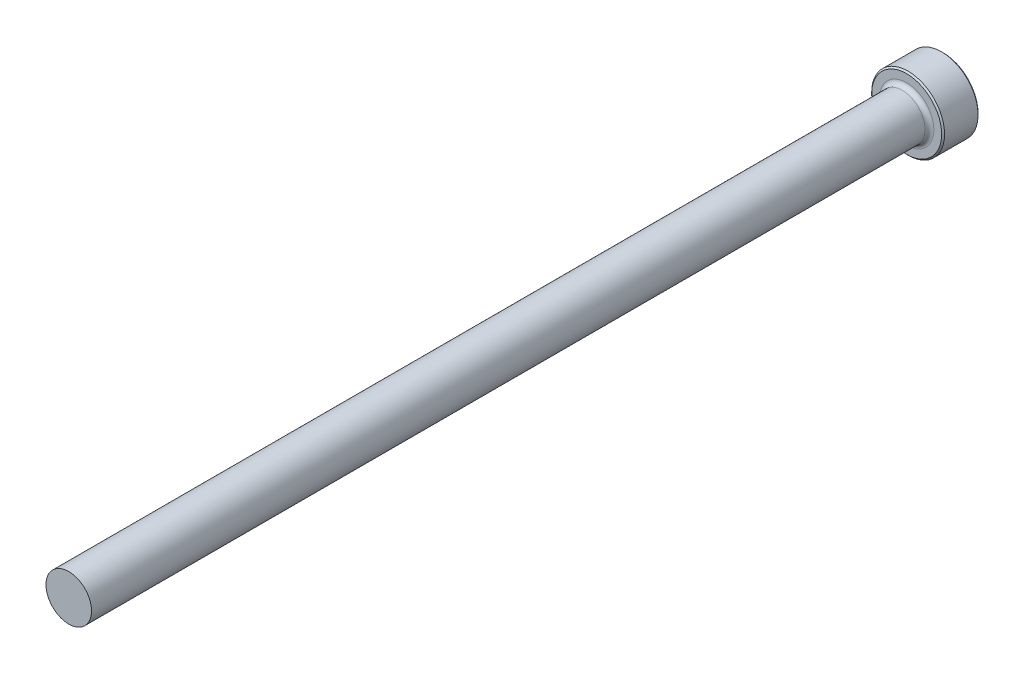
SolidWorks part; units mm, degrees
ref_plane "Front Plane" through (0, 0, 0) normal (0, 0, 1) x (1, 0, 0)
ref_plane "Top Plane" through (0, 0, 0) normal (0, 1, 0) x (1, 0, 0)
ref_plane "Right Plane" through (0, 0, 0) normal (1, 0, 0) x (0, 0, -1)
sketch "Sketch1" plane through (0, 0, 0) normal (1, 0, 0) x (0, 0, -1)
  line L0 (0, 0) -> (0, 6.35)
  line L1 (0, 6.35) -> (-6.35, 6.35)
  line L2 (-6.35, 6.35) -> (-6.35, 4.7307)
  line L3 (-7.112, 3.9687) -> (-152.4, 3.9687)
  line L4 (-152.4, 3.9687) -> (-152.4, 0)
  line L5 (-152.4, 0) -> (0, 0)
  line L6 (25.4347, 0) -> (-130.6739, 0) construction
  arc A0 (-6.35, 4.7307) -> (-7.112, 3.9687) centre (-7.112, 4.7307) cw
  dimension "D4" = 0.762
  dimension "D1" = 7.9375
  dimension "D2" = 12.7
  dimension "D3" = 6.35
  dimension "D5" = 152.4
revolve "Revolve1" add sketch "Sketch1" angle 360 about L6
chamfer "Chamfer1" distance 0.254 angle 45 2 edges at (-6.35, 0, 0) (-6.35, 0, 6.35)
